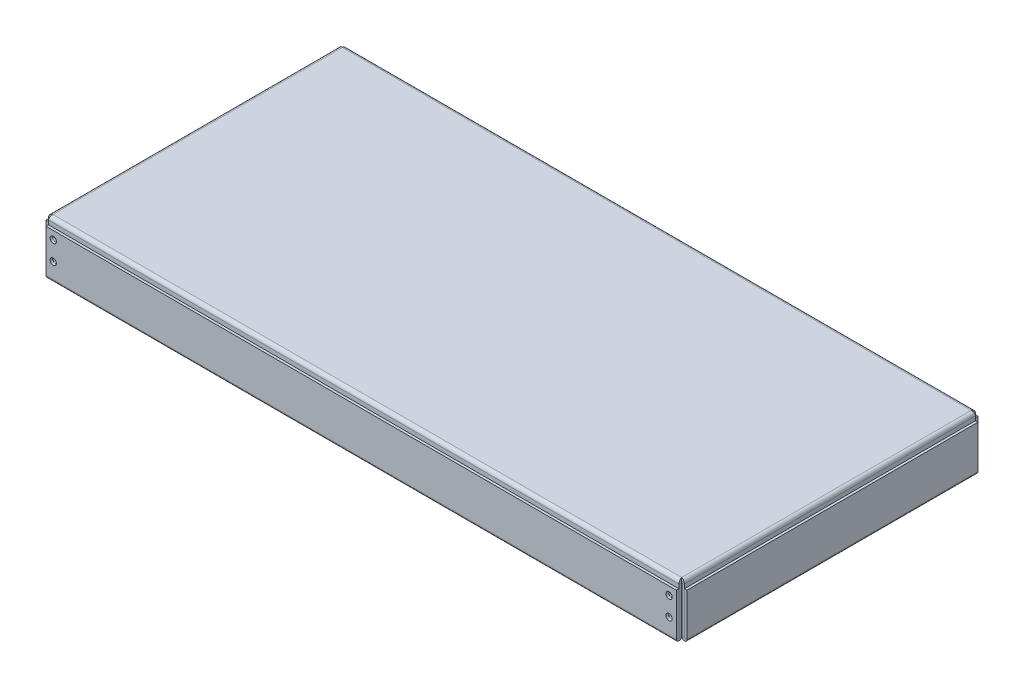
SolidWorks part; units mm, degrees
ref_plane "Front Plane" through (0, 0, 0) normal (0, 0, 1) x (1, 0, 0)
ref_plane "Top Plane" through (0, 0, 0) normal (0, 1, 0) x (1, 0, 0)
ref_plane "Right Plane" through (0, 0, 0) normal (1, 0, 0) x (0, 0, -1)
sketch "Sketch1" plane through (0, 0, 0) normal (0, 1, 0) x (1, 0, 0)
  line L0 (-321.2084, 149.7584) -> (321.2084, -149.7584) construction
  line L1 (-321.2084, 149.7584) -> (321.2084, 149.7584)
  line L2 (-321.2084, 149.7584) -> (-321.2084, -149.7584)
  line L3 (-321.2084, -149.7584) -> (321.2084, -149.7584)
  line L4 (321.2084, 149.7584) -> (321.2084, -149.7584)
  dimension "D1" = 642.4168
  dimension "D2" = 299.5168
sheet metal parameters "Sheet-Metal1" thickness 2.54 parameters "D1"=1
base flange "Base-Flange1" sketch "Sketch1" thickness 2.54 reverse thickness direction yes parameters "D1"=1
ref_plane "Plane1" through (-321.2084, 2.54, 149.7584) normal (1, 0, 0) x (0, 0, -1)
sketch "Sketch3" plane through (-321.2084, 2.54, 149.7584) normal (1, 0, 0) x (0, 0, -1)
  line L0 (0, -2.54) -> (0, -53.34)
  dimension "D1" = 50.8
miter flange "Miter Flange1" parameters "D1"=1
bend "Miterbend1" bend radius 1 bend angle 90 parameters "D5"=1
bend "Miterbend2" bend radius 1 bend angle 90 parameters "D5"=2
bend "Miterbend3" bend radius 1 bend angle 90 parameters "D5"=3
bend "Miterbend4" bend radius 1 bend angle 90 parameters "D5"=4
hem "Hem1" parameters "D1"=0.635, "D7"=45.72, "D8"=0.1016, "D9"=1
bend "HemBend1" bend radius 0.0508 bend angle 180 parameters "D5"=5
bend "HemBend2" bend radius 0.0508 bend angle 180 parameters "D5"=6
bend "HemBend3" bend radius 0.0508 bend angle 180 parameters "D5"=7
bend "HemBend4" bend radius 0.0508 bend angle 180 parameters "D5"=8
sketch "Sketch4" plane through (0, 0, 152.4) normal (0, 0, 1) x (1, 0, 0)
  line L5 (323.85, -48.2092) -> (323.85, -5.08) construction
  line L6 (-318.4888, -50.8) -> (318.4888, -50.8) construction
  line L10 (-317.6684, 2.54) -> (317.6684, 2.54) construction
  circle A1 centre (311.15, -13.335) radius 3.175
  circle A3 centre (311.15, -32.385) radius 3.175
  dimension "D2" = 6.35
  dimension "D1" = 15.875
  dimension "D3" = 12.7
  dimension "D4" = 18.415
extrude "Cut-Extrude1" cut sketch "Sketch4" against normal through all
mirror "Mirror1" about plane through (0, 0, 0) normal (1, 0, 0) of "Cut-Extrude1"
flat pattern "Flat-Pattern1"
sketch "Bend-Lines1" plane through (0, 2.54, 0) normal (0, 1, 0) x (-1, 0, 0)
  line L0 (370.518, 147.0388) -> (370.518, -147.0388) construction
  line L1 (318.4888, -199.068) -> (-318.4888, -199.068) construction
  line L2 (-370.518, -147.0388) -> (-370.518, 147.0388) construction
  line L3 (-318.4888, 199.068) -> (318.4888, 199.068) construction
  line L4 (319.4513, 147.0388) -> (319.4513, -147.0388) construction
  line L5 (318.4888, -148.0013) -> (-318.4888, -148.0013) construction
  line L6 (-319.4513, -147.0388) -> (-319.4513, 147.0388) construction
  line L7 (-318.4888, 148.0013) -> (318.4888, 148.0013) construction
  line L8 (370.518, 147.0388) -> (370.518, -147.0388) construction
  line L9 (318.4888, -199.068) -> (-318.4888, -199.068) construction
  line L10 (-370.518, -147.0388) -> (-370.518, 147.0388) construction
  line L11 (-318.4888, 199.068) -> (318.4888, 199.068) construction
  line L12 (319.4513, 147.0388) -> (319.4513, -147.0388) construction
  line L13 (318.4888, -148.0013) -> (-318.4888, -148.0013) construction
  line L14 (-319.4513, -147.0388) -> (-319.4513, 147.0388) construction
  line L15 (-318.4888, 148.0013) -> (318.4888, 148.0013) construction
sketch3d "Bounding-Box1" [suppressed]
  line L0 (-736.9303, 94.5135, 0) -> (94.5135, 94.5135, 0) construction
  line L1 (-736.9303, -394.0303, 0) -> (94.5135, -394.0303, 0) construction
  line L2 (-736.9303, 94.5135, 0) -> (-736.9303, -394.0303, 0) construction
  line L3 (94.5135, 94.5135, 0) -> (94.5135, -394.0303, 0) construction
bend of the flat pattern "Flatten-<Miterbend1>1"
bend of the flat pattern "Flatten-<Miterbend2>1"
bend of the flat pattern "Flatten-<Miterbend3>1"
bend of the flat pattern "Flatten-<Miterbend4>1"
bend of the flat pattern "Flatten-<HemBend1>1"
bend of the flat pattern "Flatten-<HemBend2>1"
bend of the flat pattern "Flatten-<HemBend3>1"
bend of the flat pattern "Flatten-<HemBend4>1"
